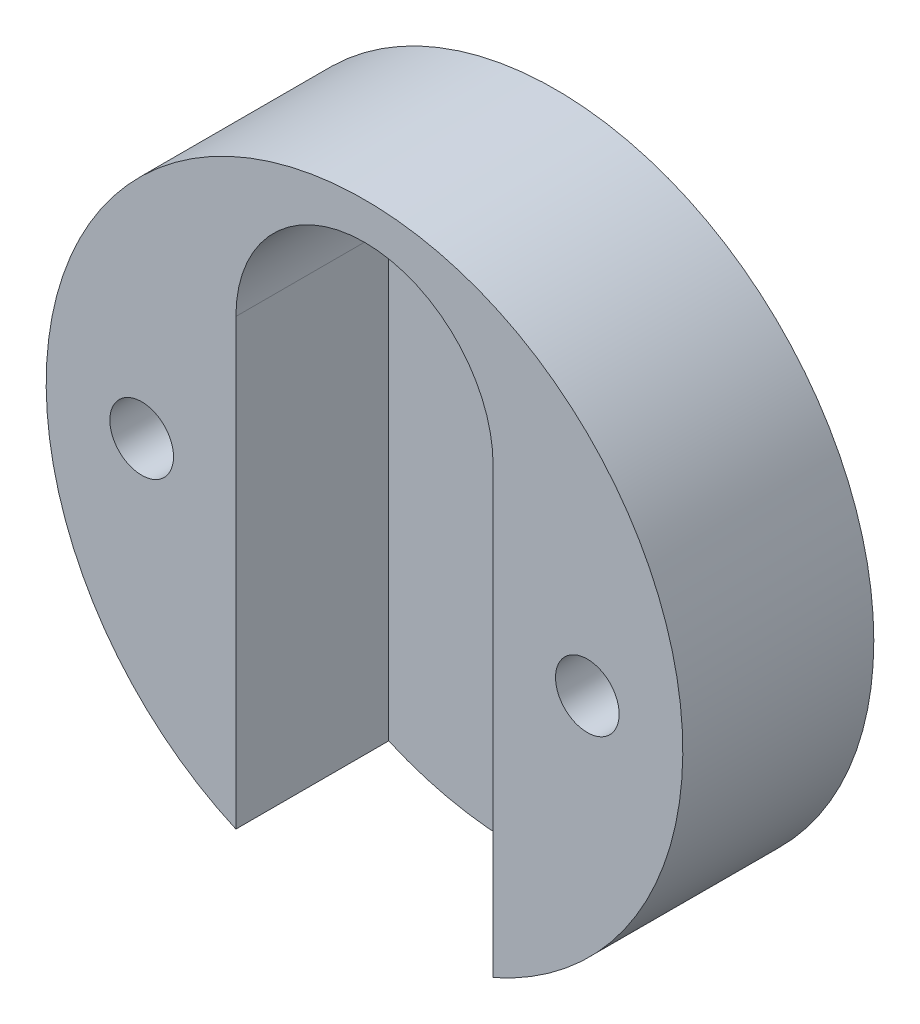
SolidWorks part; units mm, degrees
ref_plane "Plan de face" through (0, 0, 0) normal (0, 0, 1) x (1, 0, 0)
ref_plane "Plan de dessus" through (0, 0, 0) normal (0, 1, 0) x (1, 0, 0)
ref_plane "Plan de droite" through (0, 0, 0) normal (1, 0, 0) x (0, 0, -1)
sketch "Esquisse1" plane through (0, 0, 0) normal (0, 0, 1) x (1, 0, 0)
  circle A0 centre (0, 0) radius 25
  dimension "D1" = 50
extrude "Extrusion1" add sketch "Esquisse1" along normal blind 15
sketch "Esquisse2" plane through (0, 0, 15) normal (0, 0, 1) x (1, 0, 0)
  line L0 (-10.1, -25) -> (-10.1, 12)
  line L1 (10.1, 12) -> (10.1, -25)
  line L2 (10.1, -25) -> (-10.1, -25)
  arc A0 (-10.1, 12) -> (10.1, 12) centre (0, 12) cw
  circle A1 centre (0, 0) radius 25 construction
  point P4 (0, -25)
  dimension "D1" = 10.1
  dimension "D2" = 12
extrude "Enlèv. mat.-Extru.1" cut sketch "Esquisse2" against normal blind 12
hole_wizard "Trou taraudé M6x1.01" positions "Esquisse4" profile "Esquisse3" tap size "M6x1.0" standard "ISO"
sketch "Esquisse4" plane through (0, 0, 15) normal (0, 0, 1) x (1, 0, 0)
  point P0 (17.5, 0)
  point P1 (-17.5, 0)
  dimension "D1" = 35
  dimension "D2" = 17.5
sketch "Esquisse3" plane through (17.5, 0, 15) normal (1, 0, 0) x (0, -1, 0)
  line L0 (0, 0) -> (0, 15)
  line L1 (0, 15) -> (2.5, 15)
  line L2 (2.5, 15) -> (2.5, 0)
  line L5 (2.5, 0) -> (0, 0)
  line L11 (0, -6.35) -> (0, 107.95) construction
  dimension "Diamètre du trou pour taraudage jusqu'au prochain" = 5
  dimension "Profondeur du trou pour taraudage jusqu'au prochain" = 15
